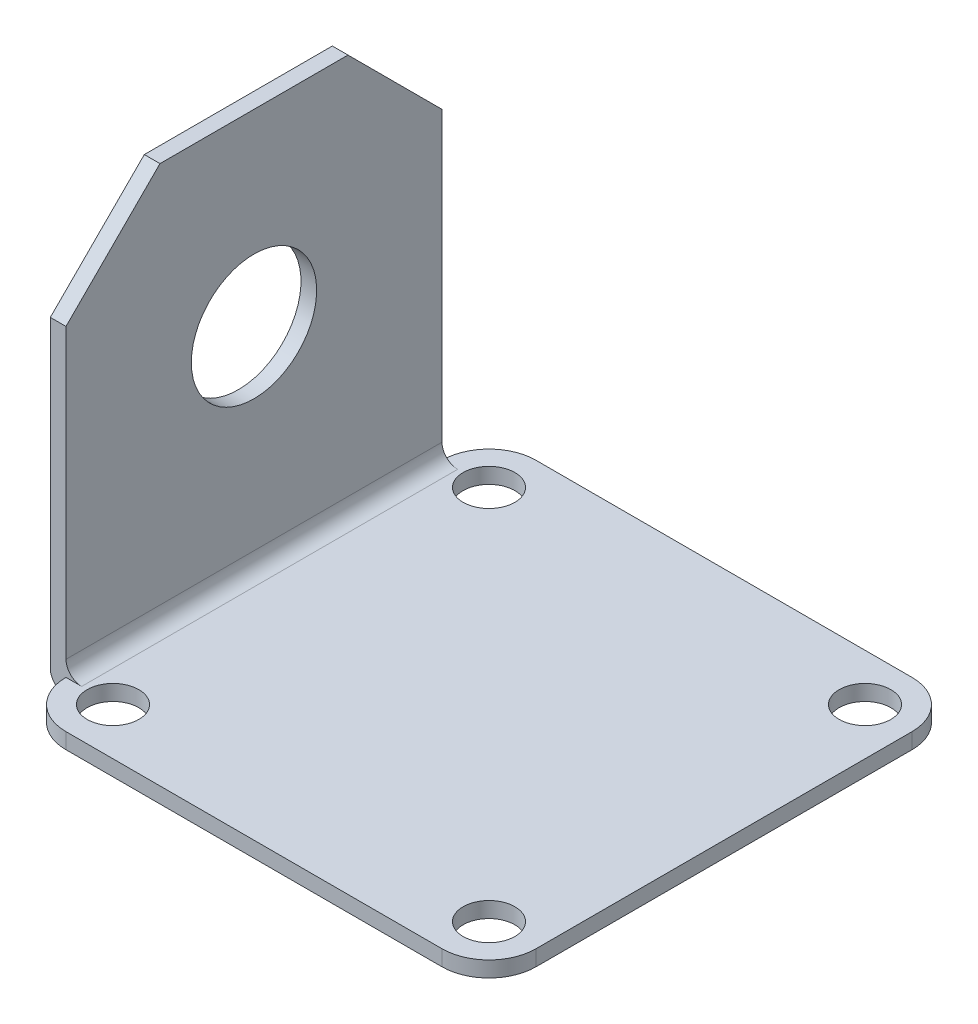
SolidWorks part; units mm, degrees
ref_plane "Plan de face" through (0, 0, 0) normal (0, 0, 1) x (1, 0, 0)
ref_plane "Plan de dessus" through (0, 0, 0) normal (0, 1, 0) x (1, 0, 0)
ref_plane "Plan de droite" through (0, 0, 0) normal (1, 0, 0) x (0, 0, -1)
sketch "Esquisse1" plane through (0, 0, 0) normal (0, 1, 0) x (1, 0, 0)
  line L0 (-53.5335, 0) -> (79.5045, 0) construction
  line L1 (0, -29.1596) -> (0, 49.6308) construction
  line L2 (30, 49.6308) -> (30, -29.1596) construction
  line L3 (64.0321, 15) -> (-16.1865, 15) construction
  line L4 (64.0321, -15) -> (-19.5191, -15) construction
  line L5 (-1, 49.6308) -> (-1, -29.1596) construction
  line L6 (-28, 44.7566) -> (-28, -29.1596) construction
  line L7 (-62.1278, 12) -> (2.9508, 12) construction
  line L8 (-62.1278, -12) -> (2.9508, -12) construction
  line L9 (15, 25.9738) -> (15, -6.0112) construction
  line L10 (27, -9.062) -> (27, -18.5515) construction
  line L11 (23.3953, -12) -> (33.0993, -12) construction
  line L12 (0, 12) -> (-1, 12)
  line L13 (-1, 12) -> (-1, -12)
  line L14 (-1, -12) -> (0, -12)
  line L20 (3, -15) -> (27, -15)
  line L22 (30, -12) -> (30, 12)
  line L23 (27, 15) -> (3, 15)
  circle A0 centre (27, -12) radius 1.65
  circle A1 centre (3, -12) radius 1.65
  circle A2 centre (3, 12) radius 1.65
  circle A3 centre (27, 12) radius 1.65
  arc A5 (30, 12) -> (27, 15) centre (27, 12) ccw
  arc A6 (27, -15) -> (30, -12) centre (27, -12) ccw
  arc A7 (0, -12) -> (3, -15) centre (3, -12) ccw
  arc A8 (3, 15) -> (0, 12) centre (3, 12) ccw
  dimension "D14" = 3
  dimension "D1" = 30
  dimension "D2" = 15
  dimension "D3" = 30
  dimension "D4" = 15
  dimension "D5" = 12
  dimension "D6" = 24
  dimension "D7" = 1
  dimension "D8" = 3
  dimension "D9" = 3
extrude "Extrusion1" add sketch "Esquisse1" along normal blind 26.4
sketch "Esquisse13" plane through (-1, 0, 0) normal (-1, 0, 0) x (0, 0, 1)
  line L0 (0, -6.0194) -> (0, 41.0168) construction
  line L1 (-21.8636, 26.4) -> (26.6088, 26.4) construction
  line L2 (-6, 33.0577) -> (-6, 11.2152) construction
  line L3 (26.6088, 20.4) -> (-22.9408, 20.4) construction
  line L4 (-8.0998, 14.4) -> (33.4907, 14.4) construction
  line L5 (-12, 33.0577) -> (-12, -8.3533) construction
  line L6 (-12, 20.4) -> (-6, 26.4)
  line L7 (-6, 26.4) -> (-6, 27.289)
  line L8 (-6, 27.289) -> (-12.889, 27.289)
  line L9 (-12.889, 27.289) -> (-12.889, 20.4)
  line L10 (-12.889, 20.4) -> (-12, 20.4)
  line L11 (12.889, 27.289) -> (12.889, 20.4)
  line L12 (6, 27.289) -> (12.889, 27.289)
  line L13 (6, 26.4) -> (6, 27.289)
  line L14 (12, 20.4) -> (6, 26.4)
  line L15 (12.889, 20.4) -> (12, 20.4)
  circle A0 centre (0, 14.4) radius 4
  dimension "D1" = 6
  dimension "D2" = 6
  dimension "D3" = 12
sketch "Esquisse14" plane through (0, 26.4, 0) normal (0, 1, 0) x (-1, 0, 0)
  line L0 (0, 20.4492) -> (0, -21.7206) construction
  line L2 (0, -16.5358) -> (-31.4371, -16.5358)
  line L3 (0, -16.5358) -> (0, 16.2322)
  line L4 (0, 16.2322) -> (-31.4371, 16.2322)
  line L5 (-31.4371, -16.5358) -> (-31.4371, 16.2322)
extrude "Enlèv. mat.-Extru.1" cut sketch "Esquisse14" against normal blind 25.4
extrude "Enlèv. mat.-Extru.2" cut sketch "Esquisse13" against normal blind 2
fillet "Congé1" radius 1 2 edges at (-1, 0, 0) (0, 1, 0)
